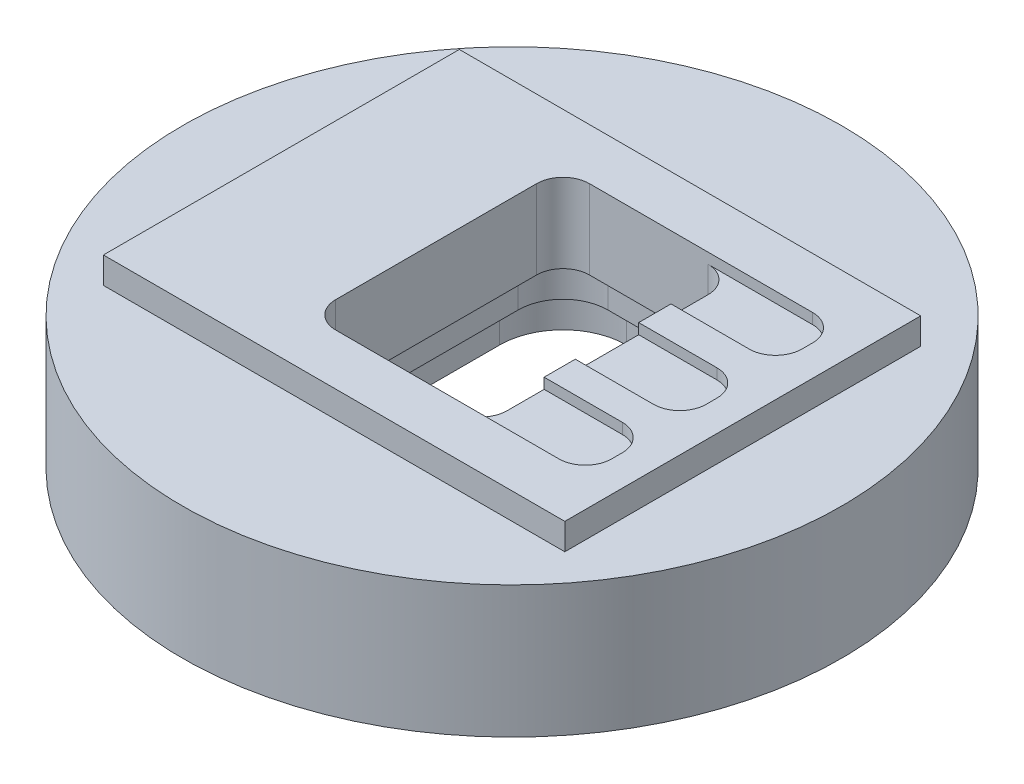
SolidWorks part; units mm, degrees
ref_plane "Front Plane" through (0, 0, 0) normal (0, 0, 1) x (1, 0, 0)
ref_plane "Top Plane" through (0, 0, 0) normal (0, 1, 0) x (1, 0, 0)
ref_plane "Right Plane" through (0, 0, 0) normal (1, 0, 0) x (0, 0, -1)
sketch "Sketch1" plane through (0, 0, 0) normal (0, 1, 0) x (1, 0, 0)
  circle A0 centre (0, 0) radius 3.175
  dimension "D1" = 6.35
extrude "pyrex base" add sketch "Sketch1" along normal blind 1.524
sketch "Sketch2" plane through (0, 1.524, 0) normal (0, 1, 0) x (1, 0, 0)
  line L0 (1.7747, -1.0695) -> (-0.5786, -1.0695) construction
  line L1 (-0.477, -1.2219) -> (1.6731, -1.2219)
  line L2 (-0.731, -0.9679) -> (-0.731, 0.9679)
  line L3 (-0.477, 1.2219) -> (1.6731, 1.2219)
  line L4 (1.9271, -0.9679) -> (1.9271, -0.8651)
  line L5 (-0.5786, 1.0695) -> (1.635, 1.0695) construction
  line L6 (-0.5786, -1.0695) -> (-0.5786, -0.0152) construction
  line L8 (1.6731, -0.6111) -> (0.492, -0.6111)
  line L9 (0.492, -0.3109) -> (1.6731, -0.3109)
  line L10 (1.9271, -0.0569) -> (1.9271, 0.0459)
  line L11 (1.6731, 0.2999) -> (0.492, 0.2999)
  line L12 (0.492, 0.6111) -> (1.6731, 0.6111)
  line L13 (1.9271, 0.8651) -> (1.9271, 0.9679)
  line L14 (0.1895, -0.7635) -> (1.635, -0.7635) construction
  line L15 (1.635, -0.1585) -> (0.3797, -0.1585) construction
  line L16 (0.3797, 0.1475) -> (1.635, 0.1475) construction
  line L17 (1.635, 0.7635) -> (0.1895, 0.7635) construction
  line L19 (1.7747, -0.7635) -> (1.7747, -1.0695) construction
  line L20 (0.1895, -0.0152) -> (0.1895, -0.7635) construction
  arc A0 (-0.731, 0.9679) -> (-0.477, 1.2219) centre (-0.477, 0.9679) cw
  arc A1 (1.6731, 1.2219) -> (1.9271, 0.9679) centre (1.6731, 0.9679) cw
  arc A2 (1.6731, -1.2219) -> (1.9271, -0.9679) centre (1.6731, -0.9679) ccw
  arc A3 (-0.477, -1.2219) -> (-0.731, -0.9679) centre (-0.477, -0.9679) cw
  arc A4 (1.9271, -0.8651) -> (1.6731, -0.6111) centre (1.6731, -0.8651) ccw
  arc A5 (0.492, -0.6111) -> (0.492, -0.3109) centre (0.492, -0.461) cw
  arc A6 (1.6731, -0.3109) -> (1.9271, -0.0569) centre (1.6731, -0.0569) ccw
  arc A7 (1.9271, 0.0459) -> (1.6731, 0.2999) centre (1.6731, 0.0459) ccw
  arc A8 (0.492, 0.2999) -> (0.492, 0.6111) centre (0.492, 0.4555) cw
  arc A9 (1.6731, 0.6111) -> (1.9271, 0.8651) centre (1.6731, 0.8651) ccw
  dimension "D1" = 0.254
  dimension "metal_clearance" = 0.1524
  dimension "D7" = 0.1524
extrude "initial cutout for trace clearance" cut sketch "Sketch2" against normal blind 0.1016
sketch "Sketch3" plane through (0, 0, 0) normal (0, -1, 0) x (1, 0, 0)
  line L0 (-0.731, -0.9679) -> (-0.731, 0.9679)
  line L1 (-0.477, 1.2219) -> (0.666, 1.2219)
  line L2 (0.92, 0.9679) -> (0.92, -0.9679)
  line L3 (0.666, -1.2219) -> (-0.477, -1.2219)
  line L4 (-0.731, -0.9679) -> (-0.731, 0.9679) construction
  line L5 (-0.477, 1.2219) -> (1.6731, 1.2219) construction
  line L6 (1.6731, -1.2219) -> (-0.477, -1.2219) construction
  arc A0 (-0.731, 0.9679) -> (-0.477, 1.2219) centre (-0.477, 0.9679) cw
  arc A1 (0.666, 1.2219) -> (0.92, 0.9679) centre (0.666, 0.9679) cw
  arc A2 (0.92, -0.9679) -> (0.666, -1.2219) centre (0.666, -0.9679) cw
  arc A3 (-0.477, -1.2219) -> (-0.731, -0.9679) centre (-0.477, -0.9679) cw
  arc A4 (-0.731, -0.9679) -> (-0.477, -1.2219) centre (-0.477, -0.9679) ccw construction
  dimension "D1" = 1.651
extrude "through all cavity" cut sketch "Sketch3" against normal through all
sketch "Sketch4" plane through (0, 1.524, 0) normal (0, 1, 0) x (1, 0, 0)
  line L1 (2.1463, 1.6383) -> (-2.1463, 1.6383) construction
  line L2 (-2.2225, 1.7145) -> (2.2225, 1.7145)
  line L3 (-2.2225, 1.7145) -> (-2.2225, -1.7145)
  line L4 (-2.2225, -1.7145) -> (2.2225, -1.7145)
  line L5 (2.2225, 1.7145) -> (2.2225, -1.7145)
  line L6 (-2.1463, 1.6383) -> (-2.1463, -1.6383) construction
  line L7 (-2.1463, -1.6383) -> (2.1463, -1.6383) construction
  line L8 (2.1463, -1.6383) -> (2.1463, 1.6383) construction
  circle A0 centre (0, 0) radius 3.175 construction
  circle A1 centre (0, 0) radius 3.175
  dimension "D1" = 0.0762
  dimension "D2" = 0.0762
  dimension "D3" = 0.0762
  dimension "D4" = 0.0762
extrude "die alignment cutout" cut sketch "Sketch4" against normal blind 0.254
sketch "Sketch5" plane through (0, 0, 0) normal (0, -1, 0) x (1, 0, 0)
  line L8 (0.666, 1.3997) -> (-0.477, 1.3997)
  line L9 (-0.9088, 0.9679) -> (-0.9088, -0.9679)
  line L10 (-0.477, -1.3997) -> (0.666, -1.3997)
  line L11 (1.0978, -0.9679) -> (1.0978, 0.9679)
  line L12 (0.666, 1.3997) -> (-0.477, 1.3997)
  line L13 (-0.9088, 0.9679) -> (-0.9088, -0.9679)
  line L14 (-0.477, -1.3997) -> (0.666, -1.3997)
  line L15 (1.0978, -0.9679) -> (1.0978, 0.9679)
  arc A8 (1.0978, 0.9679) -> (0.666, 1.3997) centre (0.666, 0.9679) ccw
  arc A9 (-0.477, 1.3997) -> (-0.9088, 0.9679) centre (-0.477, 0.9679) ccw
  arc A10 (-0.9088, -0.9679) -> (-0.477, -1.3997) centre (-0.477, -0.9679) ccw
  arc A11 (0.666, -1.3997) -> (1.0978, -0.9679) centre (0.666, -0.9679) ccw
  arc A12 (1.0978, 0.9679) -> (0.666, 1.3997) centre (0.666, 0.9679) ccw
  arc A13 (-0.477, 1.3997) -> (-0.9088, 0.9679) centre (-0.477, 0.9679) ccw
  arc A14 (-0.9088, -0.9679) -> (-0.477, -1.3997) centre (-0.477, -0.9679) ccw
  arc A15 (0.666, -1.3997) -> (1.0978, -0.9679) centre (0.666, -0.9679) ccw
  dimension "D1" = 0.1778
extrude "Cut-Extrude1" cut sketch "Sketch5" against normal blind 0.762
sketch "Sketch6" plane through (0, 0, 0) normal (0, -1, 0) x (1, 0, 0)
  line L8 (-0.477, -1.5775) -> (0.666, -1.5775)
  line L9 (1.2756, -0.9679) -> (1.2756, 0.9679)
  line L10 (0.666, 1.5775) -> (-0.477, 1.5775)
  line L11 (-1.0866, 0.9679) -> (-1.0866, -0.9679)
  line L12 (-0.477, -1.5775) -> (0.666, -1.5775)
  line L13 (1.2756, -0.9679) -> (1.2756, 0.9679)
  line L14 (0.666, 1.5775) -> (-0.477, 1.5775)
  line L15 (-1.0866, 0.9679) -> (-1.0866, -0.9679)
  arc A8 (-1.0866, -0.9679) -> (-0.477, -1.5775) centre (-0.477, -0.9679) ccw
  arc A9 (0.666, -1.5775) -> (1.2756, -0.9679) centre (0.666, -0.9679) ccw
  arc A10 (1.2756, 0.9679) -> (0.666, 1.5775) centre (0.666, 0.9679) ccw
  arc A11 (-0.477, 1.5775) -> (-1.0866, 0.9679) centre (-0.477, 0.9679) ccw
  arc A12 (-1.0866, -0.9679) -> (-0.477, -1.5775) centre (-0.477, -0.9679) ccw
  arc A13 (0.666, -1.5775) -> (1.2756, -0.9679) centre (0.666, -0.9679) ccw
  arc A14 (1.2756, 0.9679) -> (0.666, 1.5775) centre (0.666, 0.9679) ccw
  arc A15 (-0.477, 1.5775) -> (-1.0866, 0.9679) centre (-0.477, 0.9679) ccw
  dimension "D1" = 0.1778
extrude "Cut-Extrude2" cut sketch "Sketch6" against normal blind 0.381
